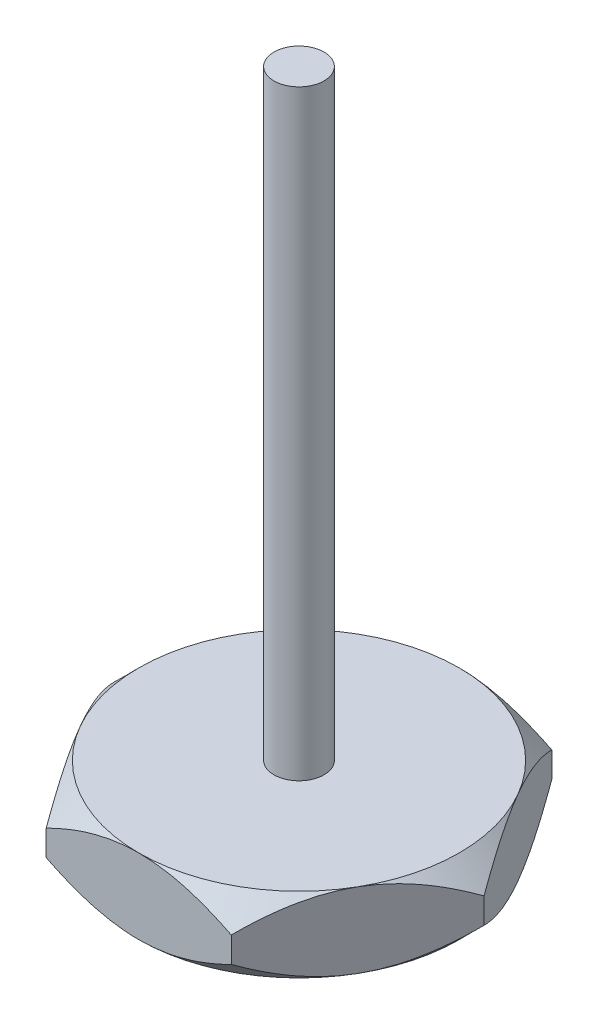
SolidWorks part; units mm, degrees
ref_plane "Front Plane" through (0, 0, 0) normal (0, 0, 1) x (1, 0, 0)
ref_plane "Top Plane" through (0, 0, 0) normal (0, 1, 0) x (1, 0, 0)
ref_plane "Right Plane" through (0, 0, 0) normal (1, 0, 0) x (0, 0, -1)
sketch "Sketch1" plane through (0, 0, 0) normal (0, 1, 0) x (1, 0, 0)
  line L1 (-4.6188, 8) -> (-9.2376, 0)
  line L2 (-9.2376, 0) -> (-4.6188, -8)
  line L3 (-4.6188, -8) -> (4.6188, -8)
  line L4 (4.6188, -8) -> (9.2376, 0)
  line L5 (9.2376, 0) -> (4.6188, 8)
  line L6 (4.6188, 8) -> (-4.6188, 8)
  circle A0 centre (0, 0) radius 8 construction
  point P1 (0, 0)
  point P10 (0, 8)
  dimension "D1" = 16
extrude "Boss-Extrude1" add sketch "Sketch1" along normal mid plane 3.75
sketch "Sketch2" plane through (0, 1.875, 0) normal (0, 1, 0) x (1, 0, 0)
  line L0 (9.2376, 0) -> (4.6188, 8) construction
  circle A0 centre (0, 0) radius 8
extrude "Cut-Extrude1" cut sketch "Sketch2" against normal blind 3.75 draft 45 flip side to cut
mirror "Mirror1" about plane through (0, 0, 0) normal (0, 1, 0) of "Cut-Extrude1"
sketch "Sketch3" plane through (0, 1.875, 0) normal (0, 1, 0) x (1, 0, 0)
  circle A0 centre (0, 0) radius 1.25
  dimension "D1" = 2.5
extrude "Boss-Extrude2" add sketch "Sketch3" along normal blind 30
